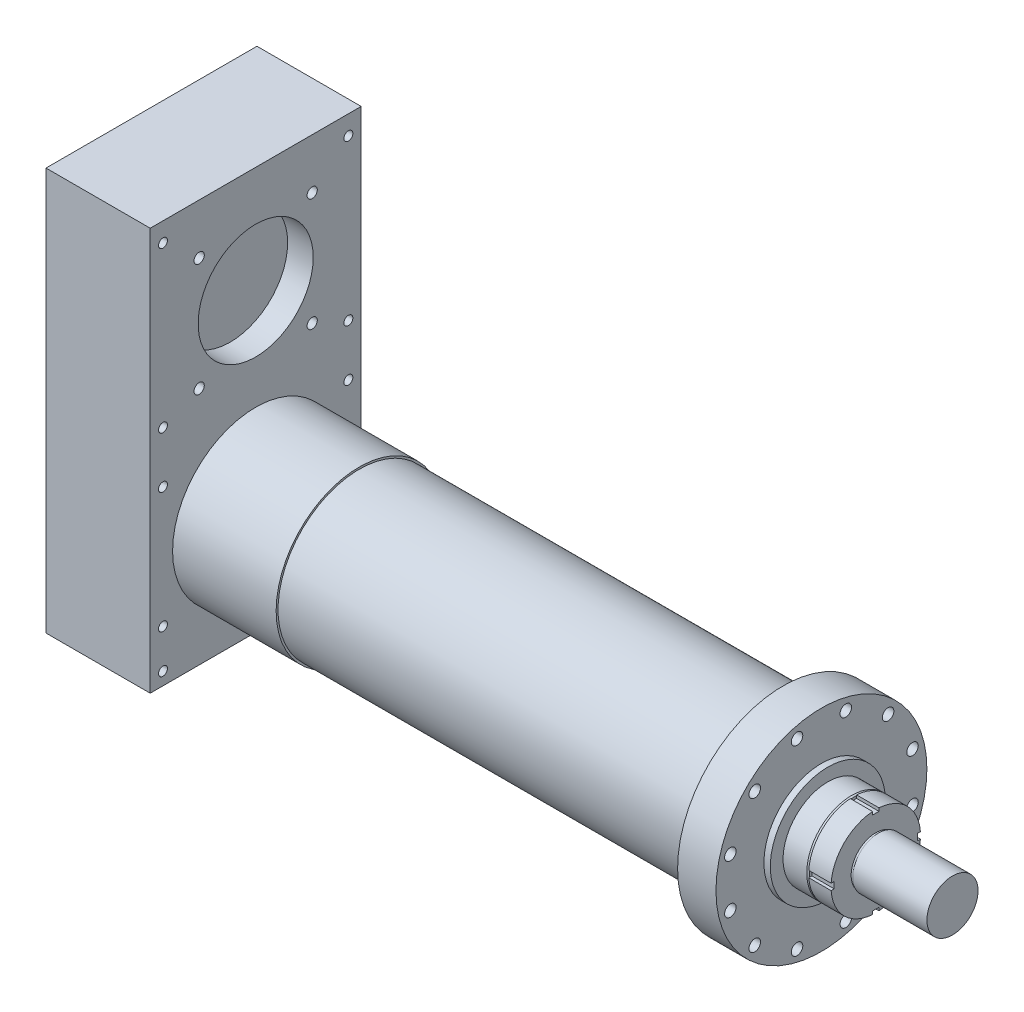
SolidWorks part; units mm, degrees
ref_plane "前视基准面" through (0, 0, 0) normal (0, 0, 1) x (1, 0, 0)
ref_plane "上视基准面" through (0, 0, 0) normal (0, 1, 0) x (1, 0, 0)
ref_plane "右视基准面" through (0, 0, 0) normal (1, 0, 0) x (0, 0, -1)
sketch "草图1" plane through (0, 0, 0) normal (1, 0, 0) x (0, 0, -1)
  circle A0 centre (0, 0) radius 127
  circle A1 centre (0, 0) radius 110
  dimension "D1" = 254
  dimension "D2" = 220
extrude "凸台-拉伸1" add sketch "草图1" along normal blind 663
sketch "草图2" plane through (663, 0, 0) normal (1, 0, 0) x (0, 0, -1)
  circle A0 centre (0, 0) radius 165
  point P0 (0, 0)
  dimension "D1" = 330
extrude "凸台-拉伸2" add sketch "草图2" along normal blind 60 separate body
sketch "草图3" plane through (723, 0, 0) normal (1, 0, 0) x (0, 0, -1)
  circle A0 centre (0, 0) radius 90
  dimension "D1" = 180
extrude "凸台-拉伸3" add sketch "草图3" along normal blind 10
sketch "草图4" plane through (723, 0, 0) normal (1, 0, 0) x (0, 0, -1)
  line L0 (0, 0) -> (38.1758, 142.4741) construction
  line L1 (0, 0) -> (0, 211.0482) construction
  circle A0 centre (0, 0) radius 147.5 construction
  circle A1 centre (38.1758, 142.4741) radius 9
  circle A2 centre (104.2983, 104.2983) radius 9
  circle A3 centre (142.4741, 38.1758) radius 9
  circle A4 centre (142.4741, -38.1758) radius 9
  circle A5 centre (104.2983, -104.2983) radius 9
  circle A6 centre (38.1758, -142.4741) radius 9
  circle A7 centre (-38.1758, -142.4741) radius 9
  circle A8 centre (-104.2983, -104.2983) radius 9
  circle A9 centre (-142.4741, -38.1758) radius 9
  circle A10 centre (-142.4741, 38.1758) radius 9
  circle A11 centre (-104.2983, 104.2983) radius 9
  circle A12 centre (-38.1758, 142.4741) radius 9
  point P30 (0, 0)
  dimension "D1" = 295
  dimension "D3" = 18
  dimension "D2" = 15
  dimension "D4" = 12
extrude "切除-拉伸1" cut sketch "草图4" against normal blind 60
sketch "草图5" plane through (733, 0, 0) normal (1, 0, 0) x (0, 0, -1)
  circle A0 centre (0, 0) radius 70
  dimension "D1" = 140
extrude "凸台-拉伸4" add sketch "草图5" along normal blind 40
chamfer "倒角1" distance 3 angle 20 1 edges at (773, 0, -70)
sketch "草图7" plane through (773, 0, 0) normal (1, 0, 0) x (0, 0, -1)
  circle A0 centre (0, 0) radius 70
  dimension "D1" = 140
extrude "凸台-拉伸5" add sketch "草图7" along normal blind 35
sketch "草图8" plane through (808, 0, 0) normal (1, 0, 0) x (0, 0, -1)
  circle A0 centre (0, 0) radius 38.5
  dimension "D1" = 77
extrude "凸台-拉伸6" add sketch "草图8" along normal blind 4
sketch "草图9" plane through (812, 0, 0) normal (1, 0, 0) x (0, 0, -1)
  circle A0 centre (0, 0) radius 40
  dimension "D1" = 80
extrude "凸台-拉伸7" add sketch "草图9" along normal blind 116
sketch "草图10" plane through (808, 0, 0) normal (1, 0, 0) x (0, 0, -1)
  line L0 (-5, -77.2193) -> (-5, -65)
  line L1 (5, -77.2193) -> (5, -65)
  line L2 (-76.4659, 5) -> (-65, 5)
  line L3 (98.9652, -5) -> (65, -5)
  line L4 (-65, 5) -> (-65, -5)
  line L5 (65, 5) -> (65, -5)
  line L6 (-5, 65) -> (5, 65)
  line L7 (-5, -65) -> (5, -65)
  line L8 (-76.4659, 5) -> (-79.4605, -5)
  line L9 (98.9652, 5) -> (98.9652, -5)
  line L10 (-5, 100.6875) -> (5, 100.6875)
  line L11 (-5, -77.2193) -> (5, -77.2193)
  line L12 (5, 65) -> (5, 100.6875)
  line L13 (-5, 65) -> (-5, 100.6875)
  line L15 (-65, -5) -> (-79.4605, -5)
  line L19 (65, 5) -> (98.9652, 5)
  dimension "D1" = 5
  dimension "D2" = 5
  dimension "D3" = 5
  dimension "D4" = 5
  dimension "D5" = 65
  dimension "D6" = 65
  dimension "D7" = 65
  dimension "D8" = 65
extrude "切除-拉伸2" cut sketch "草图10" against normal blind 35 contours L10 L12 L6 L13 | L19 L9 L3 L5 | L0 L7 L1 L11 | L8 L15 L4 L2
sketch "草图11" plane through (0, 0, 0) normal (-1, 0, 0) x (0, 0, 1)
  circle A0 centre (0, 0) radius 130
  dimension "D1" = 260
extrude "凸台-拉伸8" add sketch "草图11" along normal blind 162 separate body
sketch "草图12" plane through (-162, 0, 0) normal (-1, 0, 0) x (0, 0, 1)
  line L1 (-165, 455) -> (165, 455)
  line L2 (-165, 455) -> (-165, -175)
  line L3 (-165, -175) -> (165, -175)
  line L4 (165, 455) -> (165, -175)
  line L5 (-165, 455) -> (165, -175) construction
  line L6 (-165, -175) -> (165, 455) construction
  point P0 (0, 140)
  dimension "D1" = 175
  dimension "D2" = 330
  dimension "D3" = 630
extrude "凸台-拉伸9" add sketch "草图12" along normal blind 163 separate body
sketch "草图14" plane through (-162, 0, 0) normal (1, 0, 0) x (0, 0, -1)
  line L0 (0, 455) -> (0, 288) construction
  line L1 (-165, 455) -> (165, 455) construction
  line L2 (0, 288) -> (-88.3883, 376.3883) construction
  line L3 (-165, -175) -> (-165, 455) construction
  line L4 (165, -175) -> (-165, -175) construction
  circle A0 centre (0, 288) radius 90
  circle A1 centre (0, 288) radius 125 construction
  circle A2 centre (-88.3883, 376.3883) radius 8
  circle A3 centre (88.3883, 376.3883) radius 8
  circle A4 centre (88.3883, 199.6117) radius 8
  circle A5 centre (-88.3883, 199.6117) radius 8
  circle A6 centre (-145, 175) radius 7
  circle A7 centre (-145, 94.5) radius 7
  circle A8 centre (-145, -94.5) radius 7
  circle A9 centre (-145, -155) radius 7
  circle A10 centre (-145, 425) radius 7
  circle A11 centre (145, -155) radius 7
  circle A12 centre (145, -94.5) radius 7
  circle A13 centre (145, 94.5) radius 7
  circle A14 centre (145, 175) radius 7
  circle A15 centre (145, 425) radius 7
  point P18 (0, 288)
  dimension "D1" = 180
  dimension "D3" = 250
  dimension "D5" = 16
  dimension "D11" = 14
  dimension "D12" = 14
  dimension "D13" = 14
  dimension "D14" = 14
  dimension "D19" = 14
  dimension "D2" = 167
  dimension "D4" = 45
  dimension "D7" = 20
  dimension "D8" = 20
  dimension "D9" = 20
  dimension "D10" = 20
  dimension "D15" = 20
  dimension "D16" = 60.5
  dimension "D17" = 189
  dimension "D18" = 80.5
  dimension "D20" = 20
  dimension "D21" = 250
  dimension "D6" = 4
extrude "切除-拉伸3" cut sketch "草图14" against normal blind 40
